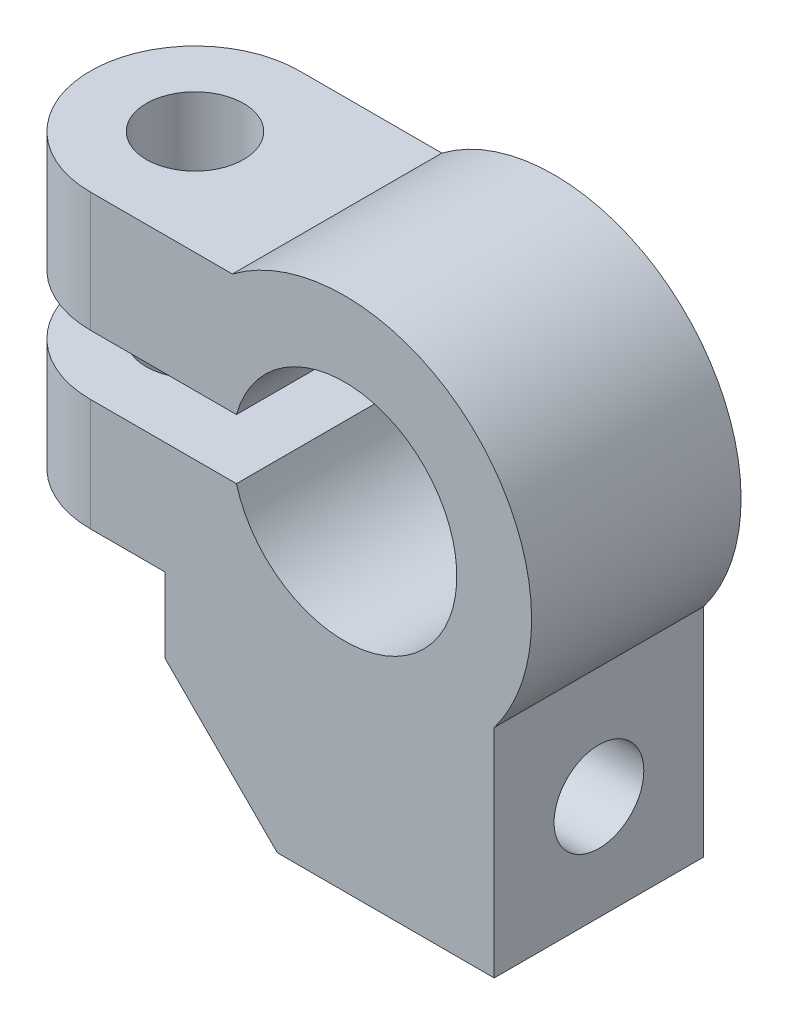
SolidWorks part; units mm, degrees
ref_plane "Plan de face" through (0, 0, 0) normal (0, 0, 1) x (1, 0, 0)
ref_plane "Plan de dessus" through (0, 0, 0) normal (0, 1, 0) x (1, 0, 0)
ref_plane "Plan de droite" through (0, 0, 0) normal (1, 0, 0) x (0, 0, -1)
sketch "Esquisse1" plane through (0, 0, 0) normal (0, 0, 1) x (1, 0, 0)
  line L0 (0, 0) -> (0, -44) construction
  line L1 (20, -44) -> (20, -15)
  line L2 (20, -44) -> (-9, -44)
  line L3 (-48, 20) -> (-15, 20)
  line L4 (-48, 20) -> (-48, -19)
  line L8 (-48, -19) -> (-24, -19)
  line L9 (-24, -19) -> (-24, -29)
  line L10 (-24, -29) -> (-9, -44)
  line L11 (-34, 20) -> (-34, -19) construction
  arc A0 (20, -15) -> (-15, 20) centre (0, 0) ccw
  dimension "D1" = 50
  dimension "D5" = 39
  dimension "D2" = 44
  dimension "D3" = 20
  dimension "D4" = 44
  dimension "D6" = 20
  dimension "D10" = 48
  dimension "D11" = 15
  dimension "D12" = 15
  dimension "D13" = 34
extrude "Extrusion1" add sketch "Esquisse1" along normal blind 28
sketch "Esquisse2" plane through (0, 20, 0) normal (0, 1, 0) x (-1, 0, 0)
  line L0 (48, 28) -> (48, 0) construction
  line L1 (15, 0) -> (48, 0) construction
  line L2 (34, 28) -> (34, 34)
  line L3 (34, 34) -> (50, 34)
  line L4 (50, 34) -> (50, -6)
  line L5 (50, -6) -> (34, -6)
  line L6 (34, -6) -> (34, 0)
  arc A0 (34, 0) -> (34, 28) centre (34, 14) ccw
  dimension "D1" = 28
  dimension "D2" = 16
  dimension "D3" = 40
extrude "Enlèv. mat.-Extru.1" cut sketch "Esquisse2" against normal through all
sketch "Esquisse3" plane through (0, 0, 28) normal (0, 0, 1) x (1, 0, 0)
  line L0 (-14.4568, 4) -> (-48, 4)
  line L1 (-48, 20) -> (-48, -19) construction
  line L2 (-48, 4) -> (-48, -4)
  line L3 (-48, -4) -> (-14.4568, -4)
  arc A0 (-14.4568, -4) -> (-14.4568, 4) centre (0, 0) ccw
  dimension "D1" = 30
  dimension "D2" = 4
  dimension "D3" = 8
extrude "Enlèv. mat.-Extru.2" cut sketch "Esquisse3" against normal through all
hole_wizard "Diamètre du perçage M12.0 (12.000000)1" positions "Esquisse3D1" profile "Esquisse4" hole size "M12.0" standard "ISO"
sketch3d "Esquisse3D1"
  line L0 (20, -44, 28) -> (20, -44, 0) construction
  line L1 (20, -44, 28) -> (20, -15, 28) construction
  point P0 (20, -30, 14)
  dimension "D1" = 14
  dimension "D2" = 14
sketch "Esquisse4" plane through (20, -30, 14) normal (0, 1, 0) x (0, 0, -1)
  line L0 (0, 0) -> (0, 21.6052)
  line L1 (0, 21.6052) -> (6, 18)
  line L2 (6, 18) -> (6, 0)
  line L5 (6, 0) -> (0, 0)
  line L10 (0, 21.6052) -> (-6, 18) construction
  line L11 (0, -6.35) -> (0, 107.95) construction
  dimension "Diamètre du perçage" = 12
  dimension "Profondeur du perçage" = 18
  dimension "Angle de pointe" = 118
hole_wizard "Diamètre du perçage M13.0 (13.000000)1" positions "Esquisse6" profile "Esquisse5" hole size "M13.0" standard "ISO"
sketch "Esquisse6" plane through (0, 20, 0) normal (0, 1, 0) x (-1, 0, 0)
  arc A0 (34, 0) -> (34, 28) centre (34, 14) ccw construction
  point P0 (34, 14)
sketch "Esquisse5" plane through (-34, 20, 14) normal (1, 0, 0) x (0, 0, 1)
  line L0 (0, 0) -> (0, 64)
  line L1 (0, 64) -> (6.5, 64)
  line L2 (6.5, 64) -> (6.5, 0)
  line L5 (6.5, 0) -> (0, 0)
  line L11 (0, -6.35) -> (0, 107.95) construction
  dimension "Diamètre du perçage jusqu'au prochain" = 13
  dimension "Profondeur du perçage jusqu'au prochain" = 64
